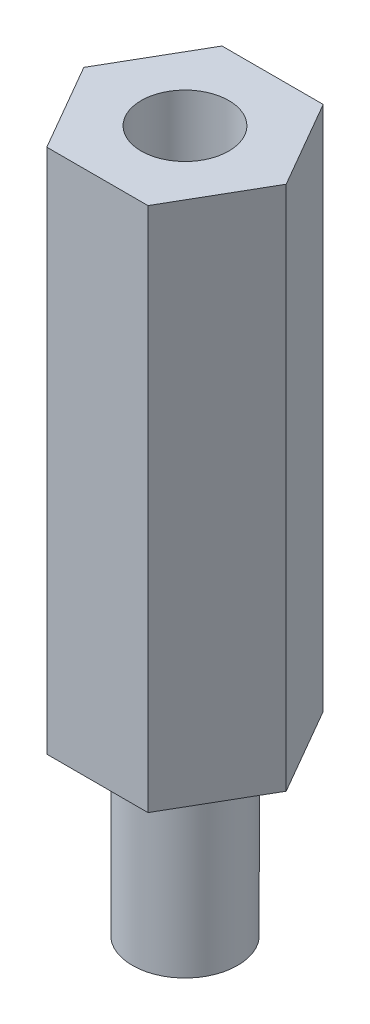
SolidWorks part; units mm, degrees
ref_plane "Aufriss" through (0, 0, 0) normal (0, 0, 1) x (1, 0, 0)
ref_plane "Grundriss" through (0, 0, 0) normal (0, 1, 0) x (1, 0, 0)
ref_plane "Seitenriss" through (0, 0, 0) normal (1, 0, 0) x (0, 0, -1)
sketch "Skizze1" plane through (0, 0, 0) normal (0, 1, 0) x (1, 0, 0)
  line L1 (2.8868, 5) -> (-2.8868, 5)
  line L2 (-2.8868, 5) -> (-5.7735, 0)
  line L3 (-5.7735, 0) -> (-2.8868, -5)
  line L4 (-2.8868, -5) -> (2.8868, -5)
  line L5 (2.8868, -5) -> (5.7735, 0)
  line L6 (5.7735, 0) -> (2.8868, 5)
  circle A0 centre (0, 0) radius 5 construction
  dimension "D1" = 10
extrude "Aufsatz-Linear austragen1" add sketch "Skizze1" along normal blind 30
sketch "Skizze4" plane through (0, 0, 0) normal (0, -1, 0) x (1, 0, 0)
  circle A0 centre (0, 0) radius 3
  dimension "D1" = 6
extrude "Aufsatz-Linear austragen2" add sketch "Skizze4" along normal blind 10
sketch "Skizze5" plane through (0, 30, 0) normal (0, 1, 0) x (1, 0, 0)
  circle A0 centre (0, 0) radius 2.5
  dimension "D1" = 5
extrude "Schnitt-Linear austragen1" cut sketch "Skizze5" against normal blind 11
